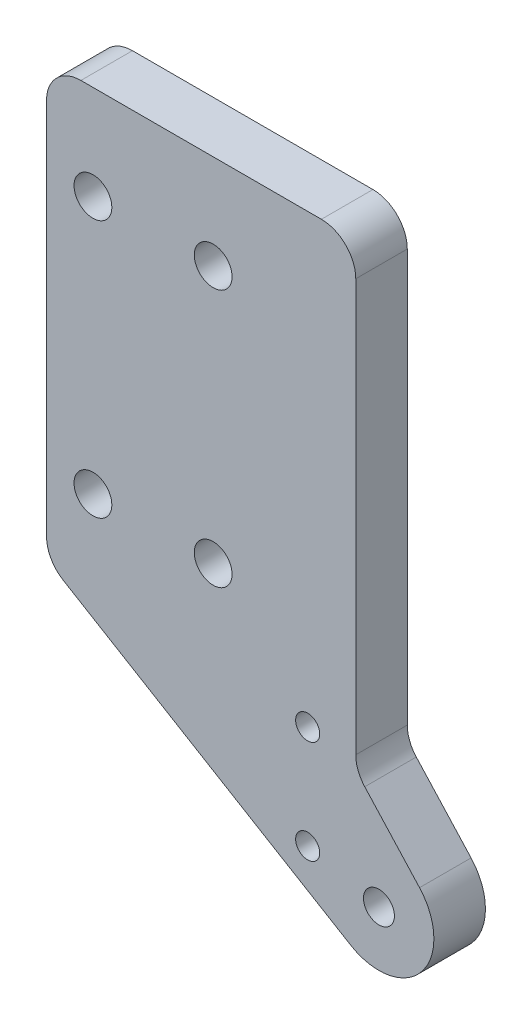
SolidWorks part; units mm, degrees
ref_plane "Plan de face" through (0, 0, 0) normal (0, 0, 1) x (1, 0, 0)
ref_plane "Plan de dessus" through (0, 0, 0) normal (0, 1, 0) x (1, 0, 0)
ref_plane "Plan de droite" through (0, 0, 0) normal (1, 0, 0) x (0, 0, -1)
sketch "Esquisse1" plane through (0, 0, 0) normal (0, 0, 1) x (1, 0, 0)
  circle A0 centre (0, 0) radius 29.5
  dimension "D1" = 59
extrude "Boss.-Extru.1" add sketch "Esquisse1" along normal blind 5
sketch "Esquisse2" plane through (0, 0, 5) normal (0, 0, 1) x (1, 0, 0)
  line L0 (47.6153, -71.7428) -> (63.5655, -89.2114)
  line L1 (-35, 65) -> (35, 65)
  line L2 (-45, 55) -> (-45, -55)
  line L4 (45, 55) -> (45, -65)
  line L5 (-40.141, -63.5773) -> (43.5244, -113.7237)
  arc A0 (45, 55) -> (35, 65) centre (35, 55) ccw
  arc A1 (-45, 55) -> (-35, 65) centre (-35, 55) cw
  arc A2 (43.5244, -113.7237) -> (63.5655, -89.2114) centre (51.75, -100) ccw
  arc A3 (47.6153, -71.7428) -> (45, -65) centre (55, -65) cw
  arc A5 (-40.141, -63.5773) -> (-45, -55) centre (-35, -55) cw
  point P7 (45, 65)
  point P10 (-45, 65)
  point P20 (0, 65)
  dimension "D3" = 10
  dimension "D4" = 10
  dimension "D5" = 32
  dimension "D8" = 10
  dimension "D9" = 120
  dimension "D10" = 10
  dimension "D1" = 90
  dimension "D2" = 65
  dimension "D6" = 96.75
  dimension "D7" = 100
  dimension "D11" = 120
extrude "Boss.-Extru.2" add sketch "Esquisse2" along normal blind 15
chamfer "Chanfrein1" distance 2 angle 45 1 edges at (29.5, 0, 0)
sketch "Esquisse3" plane through (0, 0, 20) normal (0, 0, 1) x (1, 0, 0)
  line L0 (-45, 55) -> (-45, -55) construction
  line L1 (35, 65) -> (-35, 65) construction
  circle A0 centre (-31.5, -37.5) radius 5.5
  dimension "D1" = 11
  dimension "D2" = 13.5
  dimension "D3" = 102.5
extrude "Enlèv. mat.-Extru.1" cut sketch "Esquisse3" against normal up to surface (15 mm away)
pattern_linear "Répétition linéaire1" count 2 spacing 35 along (1, 0, 0) count 2 spacing 75 along (0, 1, 0) of "Enlèv. mat.-Extru.1"
sketch "Esquisse4" plane through (0, 0, 20) normal (0, 0, 1) x (1, 0, 0)
  circle A0 centre (51.75, -100) radius 4.5
  arc A1 (43.5244, -113.7237) -> (63.5655, -89.2114) centre (51.75, -100) ccw construction
  dimension "D1" = 9
extrude "Enlèv. mat.-Extru.2" cut sketch "Esquisse4" against normal up to surface (15 mm away)
sketch "Esquisse5" plane through (0, 0, 20) normal (0, 0, 1) x (1, 0, 0)
  line L1 (45, -65) -> (45, 55) construction
  circle A0 centre (31, -65) radius 3.5
  dimension "D3" = 7
  dimension "D1" = 65
  dimension "D2" = 14
extrude "Enlèv. mat.-Extru.3" cut sketch "Esquisse5" against normal up to surface (15 mm away)
pattern_linear "Répétition linéaire2" count 2 spacing 30 along (0, -1, 0) of "Enlèv. mat.-Extru.3"
